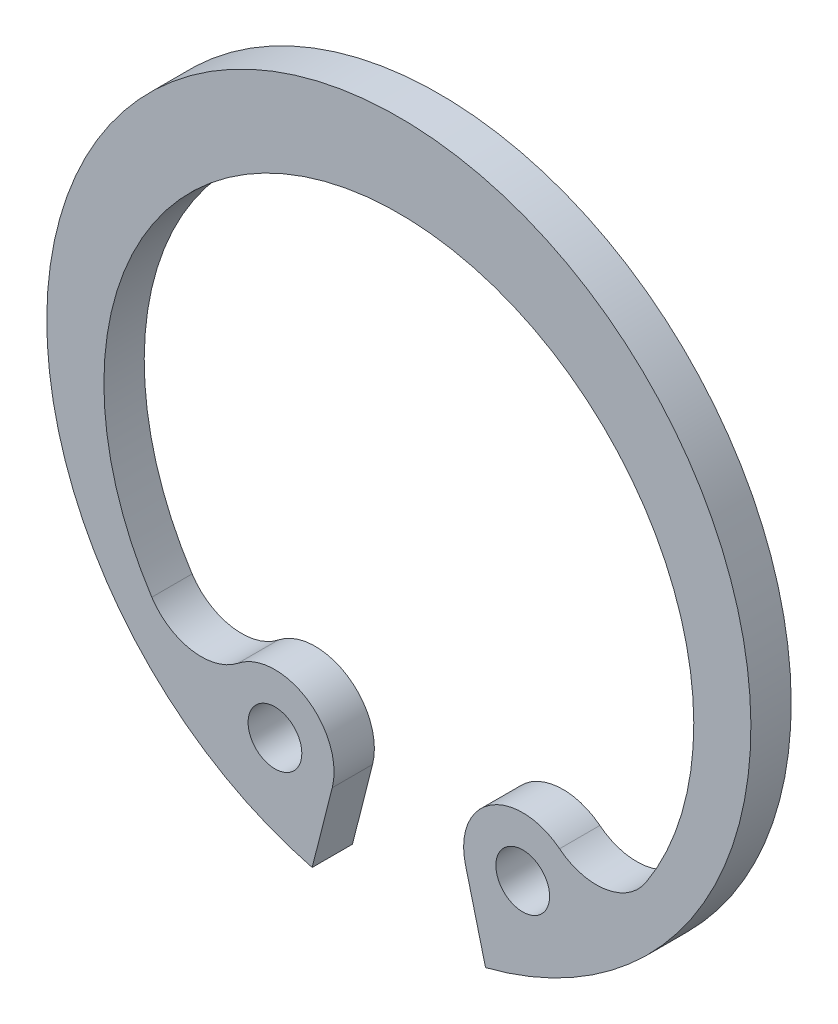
SolidWorks part; units mm, degrees
extrude "Body" add sketch "BodySke" against normal blind 1.5
sketch "BodySke" plane through (0, 0, 0) normal (0, 0, 1) x (1, 0, 0)
  line L0 (-1.5431, 0) -> (1.5431, 0) construction
  line L1 (0, 0) -> (0, 10) construction
  line L2 (3.2259, -12.6966) -> (2.4778, -9.7525)
  line L3 (-3.2259, -12.6966) -> (-2.4778, -9.7525)
  line L4 (0, 0) -> (10.3056, -8.0873) construction
  line L5 (0, 0) -> (-10.3056, -8.0873) construction
  line L6 (-4.3638, -8.2415) -> (-4.8563, -10.1799) construction
  line L7 (4.4253, -8.4832) -> (4.7949, -9.9382) construction
  arc A0 (-2.4778, -9.7525) -> (-5.9802, -7.4894) centre (-4.6101, -9.2107) ccw
  arc A1 (5.9802, -7.4894) -> (2.4778, -9.7525) centre (4.6101, -9.2107) ccw
  arc A2 (9.0862, -7.1304) -> (-9.0862, -7.1304) centre (0, -0.9749) ccw construction
  arc A3 (3.2259, -12.6966) -> (-3.2259, -12.6966) centre (0, 0) ccw
  circle A4 centre (4.6101, -9.2107) radius 1
  circle A5 centre (-4.6101, -9.2107) radius 1
  circle A6 centre (4.6101, -9.2107) radius 2.2 construction
  arc A7 (9.193, -6.9698) -> (-9.193, -6.9698) centre (0, -0.9749) ccw
  arc A8 (-4.6101, -9.2107) -> (4.6101, -9.2107) centre (0, 0) ccw construction
  arc A9 (-9.193, -6.9698) -> (-5.9802, -7.4894) centre (-7.3502, -5.7681) ccw
  arc A10 (5.9802, -7.4894) -> (9.193, -6.9698) centre (7.3502, -5.7681) ccw
ref_plane "Plane1" through (0, 0, 0) normal (0, 0, 1) x (1, 0, 0)
ref_plane "Plane2" through (0, 0, 0) normal (0, 1, 0) x (1, 0, 0)
ref_plane "Plane3" through (0, 0, 0) normal (1, 0, 0) x (0, 0, -1)
other "Configuration Table"
sketch "Clipboard" plane through (0, 0, 0) normal (0, 0, 1) x (1, 0, 0)
  line L0 (0, 0) -> (3.1, 0)
  line L1 (0, 0) -> (0, 1.55)
  line L2 (0, 0) -> (0, -5)
  circle A0 centre (0, 0) radius 1
  circle A1 centre (0, 0) radius 12.5
sketch "ModLugSke" plane through (0, 0, 0) normal (0, 0, 1) x (1, 0, 0)
  line L0 (3.2259, -12.6966) -> (2.0191, -7.9469)
  line L1 (-3.2259, -12.6966) -> (-2.0191, -7.9469)
  line L2 (7.0994, -3.8998) -> (11.4817, -6.3071) construction
  line L3 (-7.0994, -3.8998) -> (-11.4817, -6.3071) construction
  line L4 (-3.2259, -12.6966) -> (-2.4778, -9.7525) construction
  line L5 (2.4778, -9.7525) -> (3.2259, -12.6966) construction
  line L6 (0, 0) -> (0, -18.0732) construction
  line L7 (9.9888, -5.487) -> (11.4817, -6.3071)
  line L8 (-11.4817, -6.3071) -> (-9.9888, -5.487)
  arc A0 (3.2259, -12.6966) -> (11.4817, -6.3071) centre (0, 0) ccw
  arc A1 (-4.8943, -6.4541) -> (-2.0902, -7.8257) centre (0, 0) ccw
  arc A2 (3.2259, -12.6966) -> (-3.2259, -12.6966) centre (0, 0) ccw construction
  arc A3 (5.9802, -7.4894) -> (2.4778, -9.7525) centre (4.6101, -9.2107) ccw construction
  arc A4 (-4.8943, -6.4541) -> (-5.0179, -6.4562) centre (-4.9547, -6.5338) ccw
  arc A5 (-9.9888, -5.487) -> (-5.0179, -6.4562) centre (-7.0994, -3.8998) ccw
  arc A6 (9.193, -6.9698) -> (-9.193, -6.9698) centre (0, -0.9749) ccw construction
  arc A7 (5.0179, -6.4562) -> (9.9888, -5.487) centre (7.0994, -3.8998) ccw
  arc A8 (2.0902, -7.8257) -> (4.8943, -6.4541) centre (0, 0) ccw
  arc A9 (-11.4817, -6.3071) -> (-3.2259, -12.6966) centre (0, 0) ccw
  circle A10 centre (-4.6101, -9.2107) radius 1
  circle A11 centre (-4.6101, -9.2107) radius 1 construction
  circle A12 centre (4.6101, -9.2107) radius 1
  circle A13 centre (4.6101, -9.2107) radius 1 construction
  arc A14 (-2.0902, -7.8257) -> (-2.0191, -7.9469) centre (-2.116, -7.9223) cw
  arc A15 (2.0902, -7.8257) -> (2.0191, -7.9469) centre (2.116, -7.9223) ccw
  arc A16 (4.8943, -6.4541) -> (5.0179, -6.4562) centre (4.9547, -6.5338) cw
  point P43 (1.9946, -7.8506)
extrude "ModLug" [suppressed] add sketch "ModLugSke" against normal through all
sketch "UnlSke" [suppressed] plane through (0, 0, 0) normal (0, 0, 1) x (1, 0, 0)
  line L0 (1.9946, -7.8506) -> (3.2259, -12.6966)
  line L1 (-1.9946, -7.8506) -> (-3.2259, -12.6966)
  line L2 (-3.2259, -12.6966) -> (-2.0191, -7.9469) construction
  line L3 (2.0191, -7.9469) -> (3.2259, -12.6966) construction
  arc A0 (1.9946, -7.8506) -> (-1.9946, -7.8506) centre (0, 0) ccw
  arc A1 (3.2259, -12.6966) -> (-3.2259, -12.6966) centre (0, 0) ccw
  arc A2 (3.2259, -12.6966) -> (-3.2259, -12.6966) centre (0, 0) ccw construction
  circle A4 centre (-4.6101, -9.2107) radius 1
  circle A5 centre (4.6101, -9.2107) radius 1
  circle A6 centre (4.6101, -9.2107) radius 1 construction
  circle A7 centre (-4.6101, -9.2107) radius 1 construction
  arc A8 (2.0902, -7.8257) -> (4.8943, -6.4541) centre (0, 0) ccw construction
extrude "Unlug" [suppressed] add sketch "UnlSke" against normal through all
equation "' \"BoreDia@Clipboard\" = 20"
equation "' \"Thickness@Body\" = 1.5"
equation "' \"GrooveDia@BodySke\" = 21"
equation "' \"LugSection@Clipboard\" = 4.5"
equation "' \"LargeSection@Clipboard\" = 2.4"
equation "' \"HoleDia@Clipboard\" = 2"
equation "' \"BoreDia@Clipboard\" = 25"
equation "' \"GrooveDia@BodySke\" = 26.2"
equation "' \"LugSection@Clipboard\" = 5"
equation "' \"LargeSection@Clipboard\" = 3.1"
equation "\"SmallSection@Clipboard\" = \"LargeSection@Clipboard\" * 0.5"
equation "\"TipRad@BodySke\" = (\"LugSection@Clipboard\" - (\"GrooveDia@BodySke\" / 2  -  \"BoreDia@Clipboard\" / 2 ) ) / 2"
equation "\"HoleOffsetRad@BodySke\" = (\"GrooveDia@BodySke\" / 2) - \"LugSection@Clipboard\"  + \"TipRad@BodySke\""
equation "\"LargeRad@BodySke\" =  \"GrooveDia@BodySke\" / 2 -  \"LargeSection@Clipboard\""
equation "\"SmallRad@BodySke\" =  \"GrooveDia@BodySke\" / 2 -  \"SmallSection@Clipboard\""
equation "\"HoleDia@BodySke\" =  \"HoleDia@Clipboard\""
equation "\"FilletRad@BodySke\" = \"TipRad@BodySke\" * 1.0"
equation "\"GapAngle@BodySke\" = 360 - 0.965 * 360 * ( \"BoreDia@Clipboard\" /  \"GrooveDia@BodySke\")"
equation "\"LugAng@ModLugSke\" = \"GapAngle@BodySke\"  + 2 * 360 * (\"LugSection@Clipboard\" / (\"BoreDia@Clipboard\" * 3.1416))"
